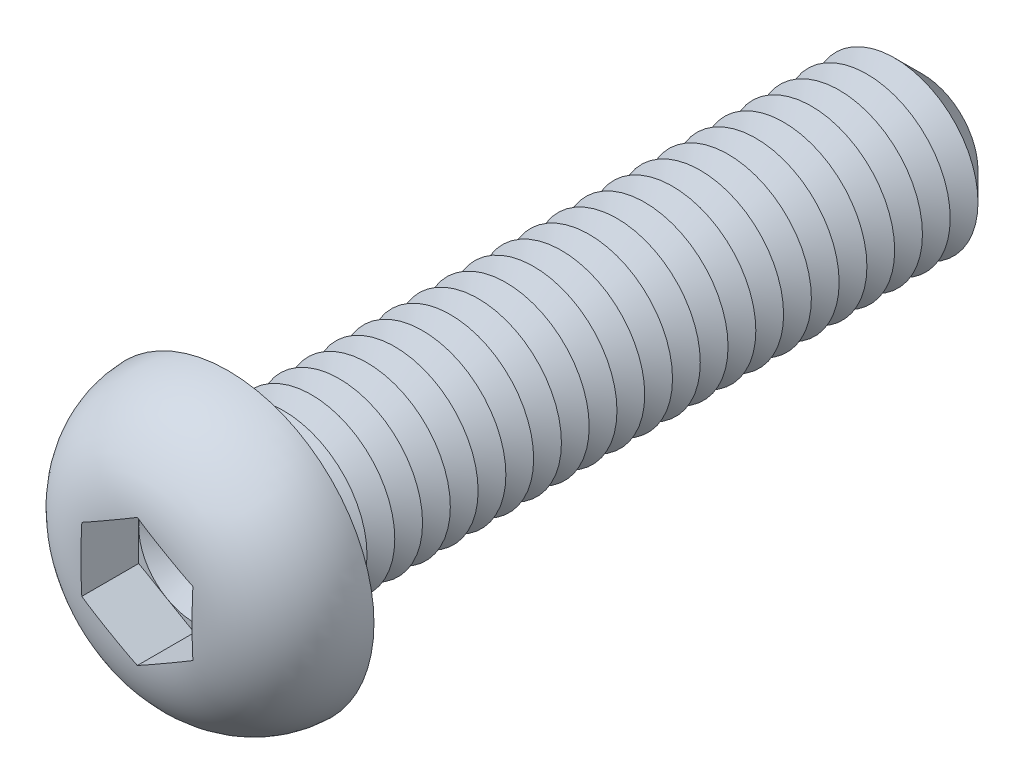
SolidWorks part; units mm, degrees
ref_plane "Front Plane" through (0, 0, 0) normal (0, 0, 1) x (1, 0, 0)
ref_plane "Top Plane" through (0, 0, 0) normal (0, 1, 0) x (1, 0, 0)
ref_plane "Right Plane" through (0, 0, 0) normal (1, 0, 0) x (0, 0, -1)
sketch "Sketch1" plane through (0, 0, 0) normal (1, 0, 0) x (0, 0, -1)
  line L0 (-47.9342, 0) -> (60.3146, 0) construction
sketch "Sketch2" plane through (0, 0, 0) normal (1, 0, 0) x (0, 0, -1)
  line L0 (0, 0) -> (-3.3, 0)
  line L1 (-47.9342, 0) -> (60.3146, 0) construction
  line L2 (-3.3, 0) -> (-3.3, 1.8515)
  line L3 (0, 5.25) -> (0, 0)
  arc A0 (-3.3, 1.8515) -> (0, 5.25) centre (0.1, 1.8515) cw
  dimension "D1" = 3.4
  dimension "D2" = 3.3
  dimension "D3" = 5.25
revolve "Revolve1" add sketch "Sketch2" angle 360 about L0
sketch "Sketch3" plane through (0, 0, 3.3) normal (0, 0, 1) x (1, 0, 0)
  line L1 (0, 2.3094) -> (-2, 1.1547)
  line L2 (-2, 1.1547) -> (-2, -1.1547)
  line L3 (-2, -1.1547) -> (0, -2.3094)
  line L4 (0, -2.3094) -> (2, -1.1547)
  line L5 (2, -1.1547) -> (2, 1.1547)
  line L6 (2, 1.1547) -> (0, 2.3094)
  circle A0 centre (0, 0) radius 2 construction
  dimension "D1" = 4
extrude "Cut-Extrude1" cut sketch "Sketch3" against normal blind 2.08
sketch "Sketch4" plane through (0, 0, 0) normal (0, 0, -1) x (-1, 0, 0)
  circle A0 centre (0, 0) radius 3
  dimension "D1" = 6
extrude "Boss-Extrude1" add sketch "Sketch4" along normal blind 25
chamfer "Chamfer1" distance 1 angle 45 1 edges at (-3, 0, -25)
sketch "Sketch5" plane through (0, 0, 0) normal (1, 0, 0) x (0, 0, -1)
  line L0 (1, 3) -> (2, 3)
  line L1 (24, 3) -> (0, 3) construction
  line L2 (2, 3) -> (1.5, 2.134)
  line L3 (1.5, 2.134) -> (1, 3)
  line L4 (0, -5.25) -> (0, 5.25) construction
  line L5 (24, 3) -> (0, 3) construction
  dimension "D1" = 1
  dimension "D2" = 1
revolve "Cut-Revolve1" cut sketch "Sketch5" angle 360 about L0
pattern_linear "LPattern1" count 23 spacing 1 along (0, 0, -1) of "Cut-Revolve1"
fillet "Fillet2" radius 0.5 1 edges at (-3, 0, 0)
sketch "Sketch6" plane through (0, 0, 1.22) normal (0, 0, 1) x (1, 0, 0)
  line L0 (0, -2.3094) -> (2, -1.1547) construction
  circle A0 centre (0, 0) radius 2
extrude "Cut-Extrude2" cut sketch "Sketch6" against normal through all draft 60
